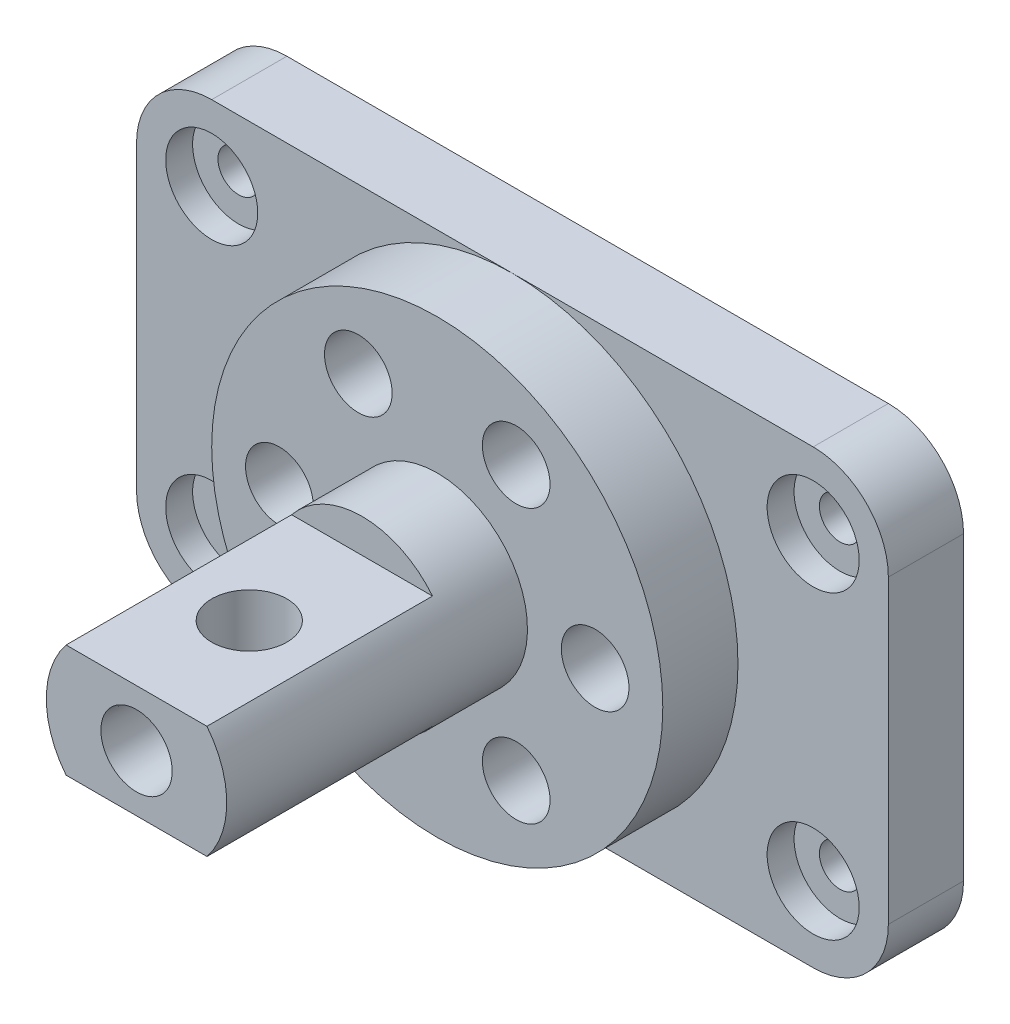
SolidWorks part; units mm, degrees
ref_plane "Front Plane" through (0, 0, 0) normal (0, 0, 1) x (1, 0, 0)
ref_plane "Top Plane" through (0, 0, 0) normal (0, 1, 0) x (1, 0, 0)
ref_plane "Right Plane" through (0, 0, 0) normal (1, 0, 0) x (0, 0, -1)
sketch "Sketch2" plane through (0, 0, 0) normal (1, 0, 0) x (0, 0, -1)
  line L0 (0, 0) -> (0, 12)
  line L1 (0, 12) -> (40, 12)
  line L2 (40, 12) -> (40, 30)
  line L3 (40, 30) -> (50, 30)
  line L4 (50, 30) -> (50, 0)
  line L5 (50, 0) -> (0, 0)
  dimension "D1" = 12
  dimension "D2" = 50
  dimension "D3" = 10
  dimension "D4" = 30
revolve "Revolve1" add sketch "Sketch2" angle 360 about L5
hole_wizard "1/8 NPT Tapped Hole1" positions "Sketch5" profile "Sketch4" size "1/8" standard "Ansi Inch"
sketch "Sketch5" plane through (0, 0, 0) normal (0, 0, 1) x (1, 0, 0)
  point P0 (0, 0)
sketch "Sketch4" plane through (0, 0, 0) normal (1, 0, 0) x (0, -1, 0)
  line L0 (0, 0) -> (0, 14.1335)
  line L1 (4.2164, 11.6) -> (0, 14.1335)
  line L2 (-4.2164, 11.6) -> (0, 14.1335) construction
  line L3 (4.2164, 11.6) -> (4.2164, 6.9)
  line L4 (4.2164, 6.9) -> (4.5374, 6.9)
  line L5 (4.5374, 6.9) -> (4.744, 0)
  line L6 (-4.5374, 6.9) -> (-4.744, 0) construction
  line L7 (4.744, 0) -> (0, 0)
  line L8 (0, -6.35) -> (0, 107.95) construction
  line L11 (-4.2164, 6.9) -> (-4.5374, 6.9) construction
  dimension "Tap Drill Dia." = 8.4328
  dimension "Tap Drill Depth" = 11.6
  dimension "Thread Dia." = 9.488
  dimension "Thread Angle" = 3.43
  dimension "Thread Depth" = 6.9
  dimension "Drill Angle" = 118
hole_wizard "M10x1.0 Tapped Hole2" positions "Sketch7" profile "Sketch6" tap size "M10x1.0" standard "Ansi Metric"
sketch "Sketch7" plane through (0, 0, -40) normal (0, 0, 1) x (1, 0, 0)
  line L0 (12, 0) -> (30, 0) construction
  circle A0 centre (0, 0) radius 12 construction
  circle A1 centre (0, 0) radius 12 construction
  circle A2 centre (0, 0) radius 30 construction
  point P0 (21, 0)
sketch "Sketch6" plane through (21, 0, -40) normal (1, 0, 0) x (0, -1, 0)
  line L0 (0, 0) -> (0, 10)
  line L1 (0, 10) -> (4.5, 10)
  line L2 (4.5, 10) -> (4.5, 0)
  line L5 (4.5, 0) -> (0, 0)
  line L11 (0, -6.35) -> (0, 107.95) construction
  dimension "Thru Tap Drill Dia." = 9
  dimension "Thru Tap Drill Depth" = 10
pattern_circular "CirPattern1" count 6 over 360 about axis through (0, 0, 0) along (0, 0, 1) of "M10x1.0 Tapped Hole2"
sketch "Sketch8" plane through (0, 0, 0) normal (0, 0, 1) x (1, 0, 0)
  line L0 (0, 0) -> (-12.6647, 0) construction
  line L1 (9.3675, -7.5) -> (-9.3675, -7.5)
  line L2 (9.3675, 7.5) -> (-9.3675, 7.5)
  circle A0 centre (0, 0) radius 12 construction
  arc A1 (9.3675, 7.5) -> (-9.3675, 7.5) centre (0, 0) ccw
  arc A2 (-9.3675, -7.5) -> (9.3675, -7.5) centre (0, 0) ccw
  dimension "D1" = 15
extrude "Cut-Extrude1" cut sketch "Sketch8" against normal blind 30
sketch "Sketch9" plane through (0, 7.5, 0) normal (0, 1, 0) x (-1, 0, 0)
  line L0 (9.3675, -15) -> (-9.3675, -15) construction
  line L1 (9.3675, -30) -> (9.3675, 0) construction
  line L2 (-9.3675, -30) -> (-9.3675, 0) construction
  circle A0 centre (0, -15) radius 5
  dimension "D1" = 10
extrude "Cut-Extrude2" cut sketch "Sketch9" against normal up to vertex (15 mm away)
sketch "Sketch10" plane through (0, 0, -50) normal (0, 0, -1) x (-1, 0, 0)
  line L0 (50, 30) -> (-50, -30) construction
  line L1 (40, 30) -> (-40, 30)
  line L2 (50, 20) -> (50, -20)
  line L3 (40, -30) -> (-40, -30)
  line L4 (-50, 20) -> (-50, -20)
  circle A0 centre (0, 0) radius 30 construction
  arc A1 (40, 30) -> (50, 20) centre (40, 20) cw
  arc A2 (50, -20) -> (40, -30) centre (40, -20) cw
  arc A3 (-40, -30) -> (-50, -20) centre (-40, -20) cw
  arc A4 (-40, 30) -> (-50, 20) centre (-40, 20) ccw
  dimension "D1" = 10
  dimension "D2" = 100
extrude "Extrude1" add sketch "Sketch10" along normal blind 10
hole_wizard "CBORE for M5 Hex Head Bolt1" positions "Sketch12" profile "Sketch11" counterbore size "M5" standard "Ansi Metric"
sketch "Sketch12" plane through (0, 0, -50) normal (0, 0, 1) x (1, 0, 0)
  point P0 (-40, 20)
  point P1 (40, 20)
  point P4 (40, -20)
  point P7 (-40, -20)
sketch "Sketch11" plane through (-40, 20, -50) normal (1, 0, 0) x (0, -1, 0)
  line L0 (0, 0) -> (0, 10)
  line L1 (0, 10) -> (2.75, 10)
  line L3 (2.75, 10) -> (2.75, 3.58)
  line L4 (2.75, 3.58) -> (6.12, 3.58)
  line L5 (6.12, 3.58) -> (6.12, 0)
  line L7 (6.12, 0) -> (0, 0)
  line L11 (0, -6.35) -> (0, 107.95) construction
  dimension "Thru Hole Dia." = 5.5
  dimension "Thru Hole Depth" = 10
  dimension "C'Bore Dia." = 12.24
  dimension "C'Bore Depth" = 3.58
sketch "Sketch13" plane through (0, 0, -60) normal (0, 0, -1) x (-1, 0, 0)
  circle A0 centre (0, 0) radius 15
  circle A1 centre (0, 0) radius 12 construction
  dimension "D1" = 30
extrude "Cut-Extrude3" cut sketch "Sketch13" against normal blind 5
